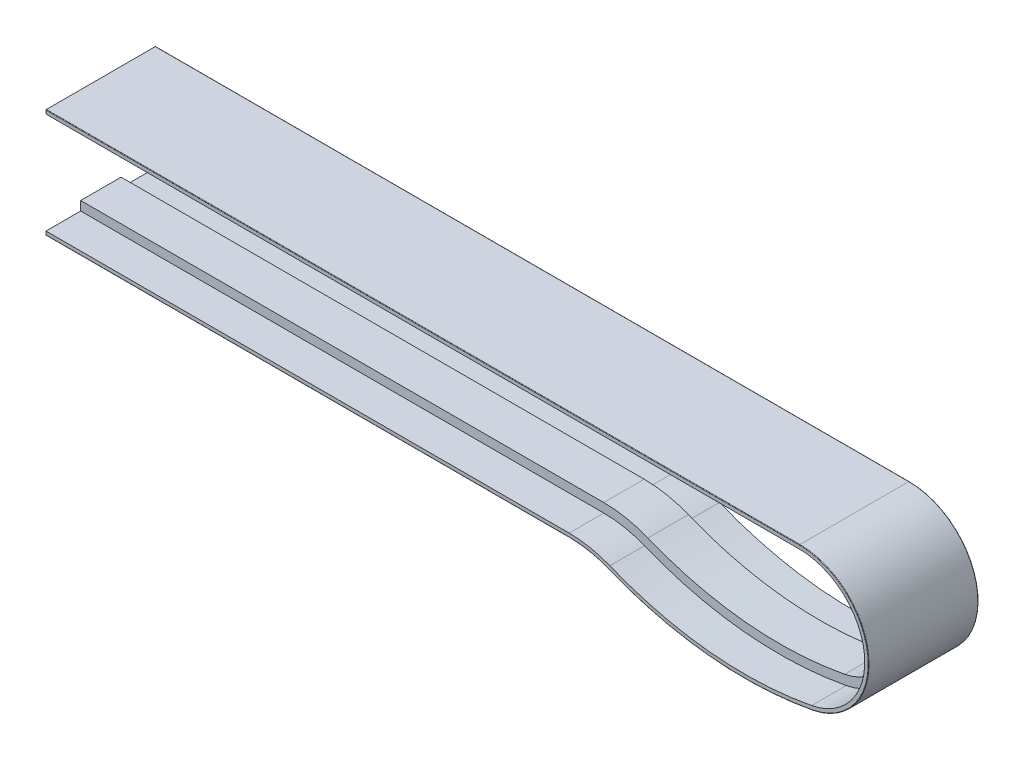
SolidWorks part; units mm, degrees
ref_plane "Plan de face" through (0, 0, 0) normal (0, 0, 1) x (1, 0, 0)
ref_plane "Plan de dessus" through (0, 0, 0) normal (0, 1, 0) x (1, 0, 0)
ref_plane "Plan de droite" through (0, 0, 0) normal (1, 0, 0) x (0, 0, -1)
sketch "Esquisse2" plane through (0, 0, 0) normal (1, 0, 0) x (0, 0, -1)
  line L0 (-56.65, 0) -> (56.65, 0)
  line L1 (-57.15, -0.5) -> (-57.15, -4)
  line L2 (-57.15, -4) -> (-21.05, -4)
  line L3 (-21.05, -4) -> (-21.05, -13.5)
  line L4 (-21.05, -13.5) -> (21.05, -13.5)
  line L5 (21.05, -13.5) -> (21.05, -4)
  line L6 (21.05, -4) -> (57.15, -4)
  line L7 (57.15, -4) -> (57.15, -0.5)
  line L8 (0, 0) -> (0, -13.5) construction
  arc A0 (-56.65, 0) -> (-57.15, -0.5) centre (-56.65, -0.5) ccw
  arc A1 (57.15, -0.5) -> (56.65, 0) centre (56.65, -0.5) ccw
  point P15 (57.15, 0)
  dimension "D6" = 0.5
  dimension "D1" = 114.3
  dimension "D2" = 42.1
  dimension "D3" = 4
  dimension "D5" = 13.5
  dimension "D7" = 57.15
sketch "Esquisse3" plane through (0, 0, 0) normal (0, 0, -1) x (-1, 0, 0)
  line L0 (-785, 0) -> (0, 0)
  line L3 (-545, -113.5) -> (0, -113.5)
  arc A1 (-545, -113.5) -> (-585.9001, -121.5041) centre (-545, -222) ccw
  arc A3 (-798.4072, -142.7407) -> (-585.9001, -121.5041) centre (-728.142, 228) ccw
  arc A8 (-785, 0) -> (-798.4072, -142.7407) centre (-785, -72) ccw
  dimension "D1" = 785
  dimension "D2" = 300
  dimension "D6" = 240
  dimension "D3" = 72
  dimension "D4" = 150
  dimension "D5" = 113.5
sweep "Balayage1" add profiles "Esquisse2" path "Esquisse3"
